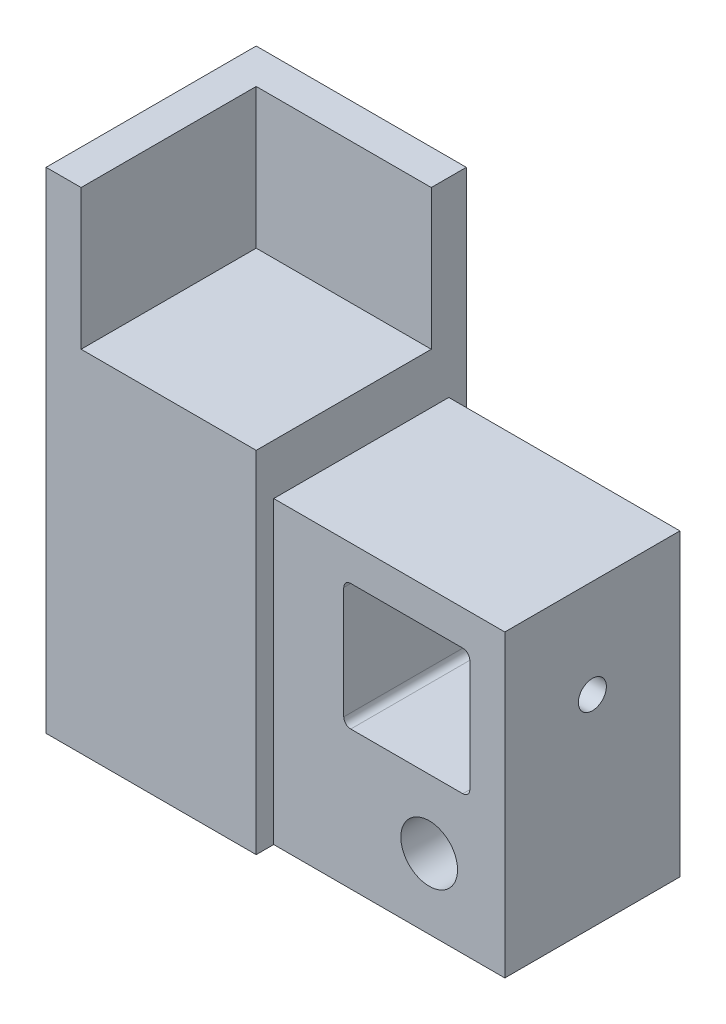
SolidWorks part; units mm, degrees
ref_plane "Alzado" through (0, 0, 0) normal (0, 0, 1) x (1, 0, 0)
ref_plane "Planta" through (0, 0, 0) normal (0, 1, 0) x (1, 0, 0)
ref_plane "Vista lateral" through (0, 0, 0) normal (1, 0, 0) x (0, 0, -1)
sketch "Croquis1" plane through (0, 0, 0) normal (0, 1, 0) x (1, 0, 0)
  line L1 (-15, -15) -> (15, -15)
  line L2 (-15, -15) -> (-15, 15)
  line L3 (-15, 15) -> (15, 15)
  line L4 (15, -15) -> (15, 15)
  line L5 (-15, -15) -> (15, 15) construction
  line L6 (-15, 15) -> (15, -15) construction
  point P0 (0, 0)
  dimension "D1" = 30
  dimension "D2" = 30
extrude "Saliente-Extruir1" add sketch "Croquis1" along normal blind 50
sketch "Croquis2" plane through (0, 0, 0) normal (0, -1, 0) x (1, 0, 0)
  line L1 (-10, -10) -> (10, -10)
  line L2 (-10, -10) -> (-10, 10)
  line L3 (-10, 10) -> (10, 10)
  line L4 (10, -10) -> (10, 10)
  line L5 (-10, -10) -> (10, 10) construction
  line L6 (-10, 10) -> (10, -10) construction
  point P0 (0, 0)
  dimension "D1" = 20
  dimension "D2" = 20
extrude "Cortar-Extruir1" cut sketch "Croquis2" against normal offset from surface (45 mm away) 5
sketch "Croquis3" plane through (0, 0, 0) normal (0, 0, 1) x (1, 0, 0)
  line L0 (15, 50) -> (15, 0) construction
  line L2 (15, 42.79) -> (15, 0)
  line L4 (25, 37.79) -> (25, 19.79)
  line L5 (-15, 50) -> (15, 50) construction
  line L6 (48, 28.79) -> (17.5282, 28.79) construction
  line L8 (48, 42.79) -> (48, 0)
  line L10 (43, 37.79) -> (43, 19.79)
  line L13 (25, 37.79) -> (43, 37.79)
  line L17 (25, 19.79) -> (43, 19.79)
  line L19 (48, 0) -> (15, 0)
  line L20 (15, 10) -> (37.2, 10) construction
  line L21 (37.2, 0) -> (37.2, 10) construction
  line L22 (15, 42.79) -> (48, 42.79)
  circle A0 centre (37.2, 10) radius 4.05
  point P8 (25, 28.79)
  dimension "D3" = 8.1
  dimension "D1" = 10
  dimension "D2" = 21.21
  dimension "D4" = 5
  dimension "D5" = 18
  dimension "D6" = 18
  dimension "D7" = 10
  dimension "D8" = 5
  dimension "D9" = 22.2
extrude "Saliente-Extruir2" add sketch "Croquis3" along normal blind 12.5 and the other way blind 12.5
fillet "Redondeo2" radius 1 4 edges at (43, 19.79, 0) (25, 19.79, 0) (25, 37.79, 0) (43, 37.79, 0)
sketch "Croquis5" plane through (0, 0, -12.5) normal (0, 0, -1) x (-1, 0, 0)
  line L0 (-48, 0) -> (-48, 42.79) construction
  line L1 (-15, 0) -> (-48, 0)
  line L2 (-15, 0) -> (-15, 15)
  line L3 (-15, 15) -> (-48, 15)
  line L4 (-48, 0) -> (-48, 15)
  dimension "D1" = 15
extrude "Saliente-Extruir3" add sketch "Croquis5" against normal offset from surface (7.5 mm away) 10 from offset 10 contours L3 L4 L1 L2
sketch "Croquis6" plane through (48, 0, 0) normal (1, 0, 0) x (0, 0, -1)
  line L0 (0, 0) -> (0, 28.8) construction
  line L1 (0, 28.8) -> (12.5, 28.8) construction
  line L2 (12.5, 42.79) -> (12.5, 0) construction
  line L4 (-15, 50) -> (15, 50) construction
  circle A0 centre (0, 28.8) radius 2
  dimension "D1" = 4
  dimension "D2" = 21.2
extrude "Cortar-Extruir3" cut sketch "Croquis6" against normal offset from surface (28 mm away) 5
sketch "Croquis7" plane through (0, 50, 0) normal (0, 1, 0) x (1, 0, 0)
  line L0 (15, 15) -> (15, 10)
  line L1 (15, -15) -> (15, 15) construction
  line L2 (15, 10) -> (-10, 10)
  line L3 (-10, 10) -> (-10, -15)
  line L4 (-15, -15) -> (15, -15) construction
  line L5 (-10, -15) -> (-15, -15)
  line L6 (15, 15) -> (-15, 15) construction
  line L7 (-15, 15) -> (-15, -15) construction
  line L8 (15, 15) -> (-15, 15)
  line L9 (-15, 15) -> (-15, -15)
  dimension "D1" = 5
  dimension "D2" = 5
extrude "Saliente-Extruir4" add sketch "Croquis7" along normal blind 20
